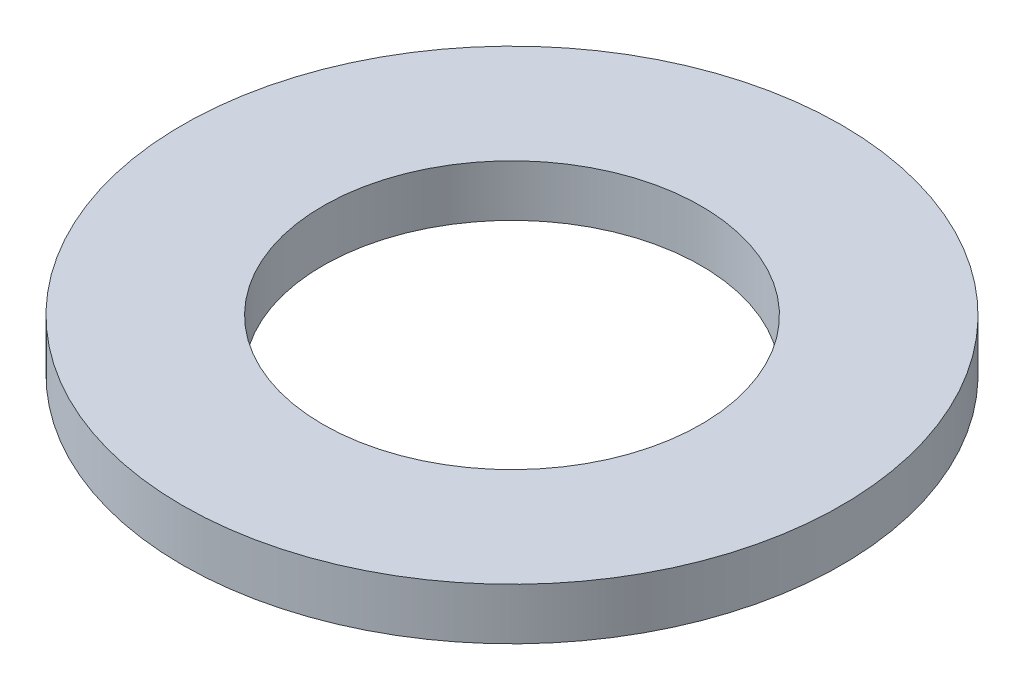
SolidWorks part; units mm, degrees
ref_plane "Front" through (0, 0, 0) normal (0, 0, 1) x (1, 0, 0)
ref_plane "Top" through (0, 0, 0) normal (0, 1, 0) x (1, 0, 0)
ref_plane "Right" through (0, 0, 0) normal (1, 0, 0) x (0, 0, -1)
sketch "Sketch1" plane through (0, 0, 0) normal (0, 1, 0) x (1, 0, 0)
  circle A0 centre (0, 0) radius 33
  circle A1 centre (0, 0) radius 57.5
extrude "Extrude1" add sketch "Sketch1" along normal blind 9
